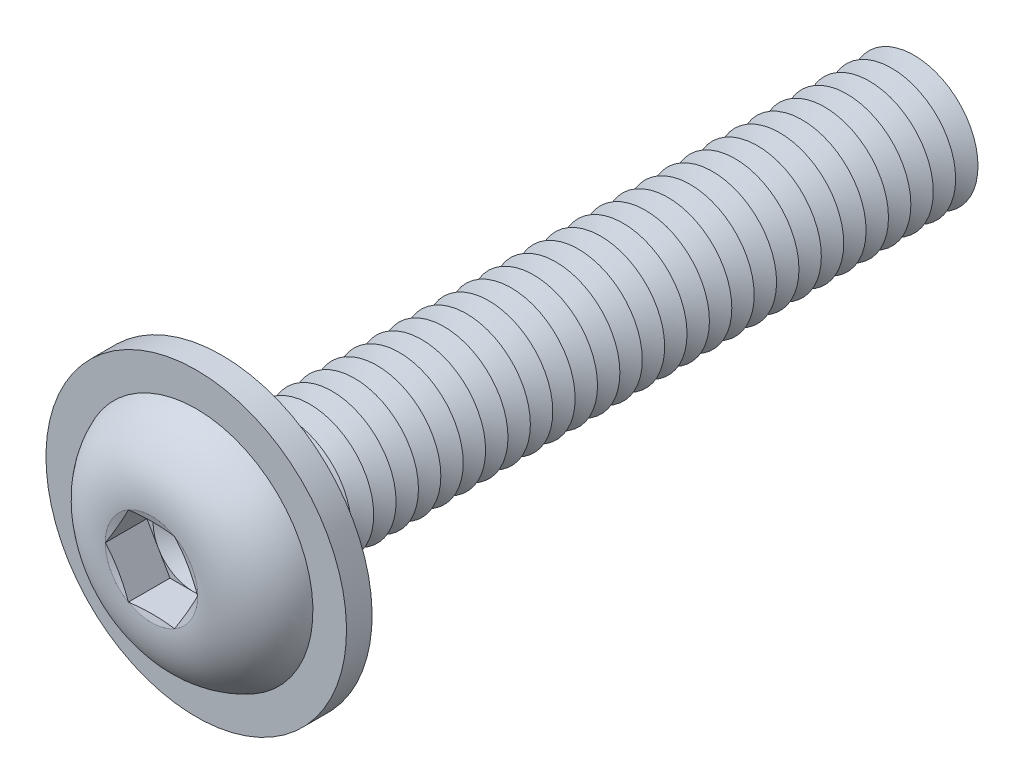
SolidWorks part; units mm, degrees
ref_plane "Front Plane" through (0, 0, 0) normal (0, 0, 1) x (1, 0, 0)
ref_plane "Top Plane" through (0, 0, 0) normal (0, 1, 0) x (1, 0, 0)
ref_plane "Right Plane" through (0, 0, 0) normal (1, 0, 0) x (0, 0, -1)
sketch "Sketch1" plane through (0, 0, 0) normal (1, 0, 0) x (0, 0, -1)
  line L0 (0, 2) -> (0, 3.8)
  line L3 (0, 2) -> (22, 2)
  line L4 (22, 2) -> (22, 0)
  line L5 (22, 0) -> (-2.2, 0) construction
  line L6 (-2.2, 0) -> (22, 0)
  line L7 (-2.2, 1.4434) -> (-2.2, 0.7217) construction
  line L8 (-2.2, 0.7217) -> (-2.2, 0)
  line L9 (-2.2, 1.4434) -> (-2.0066, 0.7217)
  line L10 (-2.0066, 0.7217) -> (-2.2, 0.7217)
  line L11 (22, 0) -> (22.7481, 0) construction
  line L12 (0, 3.8) -> (-2.2, 3.8) construction
  arc A1 (0, 3.8) -> (-2.2, 1.4434) centre (0, 1.5948) ccw
  point P8 (22, 1)
  dimension "D1" = 7.6
  dimension "D2" = 4
  dimension "D3" = 2.2
  dimension "D4" = 2.8868
  dimension "D5" = 22
  dimension "D6" = 15
revolve "Revolve1" add sketch "Sketch1" angle 360 about L5
fillet "Fillet1" radius 0.35 1 edges at (-2, 0, 0)
sketch "Sketch2" plane through (0, 0, 0) normal (1, 0, 0) x (0, 0, -1)
  line L0 (21.65, 2) -> (22.35, 2)
  line L1 (22, 2) -> (0.35, 2) construction
  line L2 (22.35, 2) -> (22, 1.3938)
  line L3 (22, -2) -> (22, 2) construction
  line L4 (22, 1.3938) -> (21.65, 2)
  dimension "D1" = 0.7
revolve "Cut-Revolve1" cut sketch "Sketch2" angle 360 about axis through (0, 0, -22) along (0, 0, -1)
pattern_linear "LPattern1" count 31 spacing 0.7 along (0, 0, 1) of "Cut-Revolve1"
sketch "Sketch3" plane through (0, 0, 2.2) normal (0, 0, 1) x (1, 0, 0)
  line L7 (0.7217, 1.25) -> (-0.7217, 1.25)
  line L8 (-0.7217, 1.25) -> (-1.4434, 0)
  line L9 (-1.4434, 0) -> (-0.7217, -1.25)
  line L10 (-0.7217, -1.25) -> (0.7217, -1.25)
  line L11 (0.7217, -1.25) -> (1.4434, 0)
  line L12 (1.4434, 0) -> (0.7217, 1.25)
  circle A0 centre (0, 0) radius 1.25 construction
  circle A3 centre (0, 0) radius 1.4434 construction
extrude "Cut-Extrude1" cut sketch "Sketch3" against normal blind 1.3
sketch "Sketch4" plane through (0, 0, 0.9) normal (0, 0, 1) x (1, 0, 0)
  line L1 (0.7217, 1.25) -> (-0.7217, 1.25) construction
  circle A0 centre (0, 0) radius 1.25
extrude "Cut-Extrude2" cut sketch "Sketch4" against normal through all draft 60
sketch "Sketch5" plane through (0, 0, 0) normal (0, 0, -1) x (-1, 0, 0)
  circle A0 centre (0, 0) radius 4.7
  circle A1 centre (0, 0) radius 2.35
  circle A2 centre (0, 0) radius 2.35 construction
  dimension "D1" = 9.4
extrude "Boss-Extrude1" add sketch "Sketch5" against normal blind 0.8
